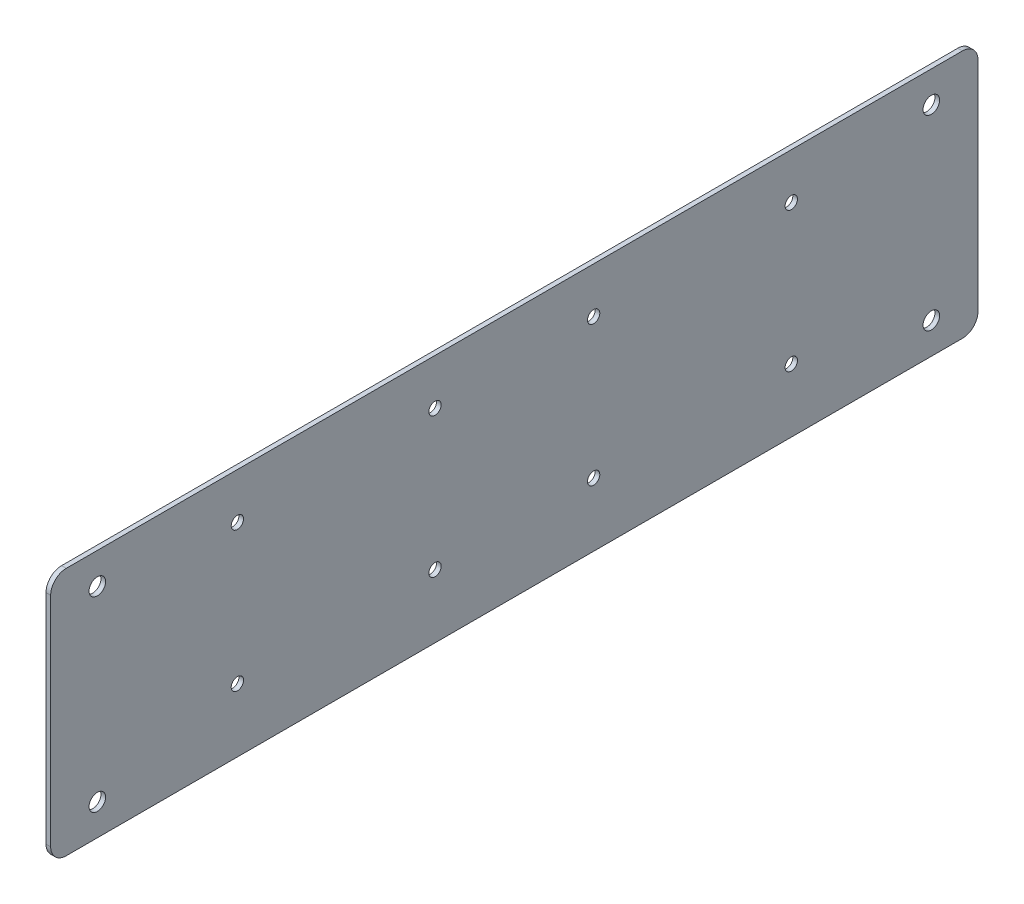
SolidWorks part; units mm, degrees
ref_plane "Front" through (0, 0, 0) normal (0, 0, 1) x (1, 0, 0)
ref_plane "Top" through (0, 0, 0) normal (0, 1, 0) x (1, 0, 0)
ref_plane "Right" through (0, 0, 0) normal (1, 0, 0) x (0, 0, -1)
sketch "Sketch1" plane through (-51.7423, 0, 0) normal (-1, 0, 0) x (0, 0, 1)
  line L0 (99.888, 634.9484) -> (99.888, 81.2564) construction
  line L1 (106.238, 364.5139) -> (471.998, 364.5139)
  line L2 (99.888, 358.1639) -> (99.888, 269.2639)
  line L3 (106.238, 262.9139) -> (471.998, 262.9139)
  line L4 (478.348, 358.1639) -> (478.348, 269.2639)
  arc A0 (478.348, 269.2639) -> (471.998, 262.9139) centre (471.998, 269.2639) cw
  arc A1 (478.348, 358.1639) -> (471.998, 364.5139) centre (471.998, 358.1639) ccw
  arc A2 (99.888, 269.2639) -> (106.238, 262.9139) centre (106.238, 269.2639) ccw
  arc A3 (99.888, 358.1639) -> (106.238, 364.5139) centre (106.238, 358.1639) cw
  point P10 (478.348, 262.9139)
  point P13 (478.348, 364.5139)
  point P18 (99.888, 364.5139)
  dimension "D2" = 6.35
  dimension "D1" = 101.6
  dimension "D3" = 378.46
extrude "Boss-Extrude1" add sketch "Sketch1" along normal blind 1.905
sketch "Sketch2" plane through (-51.7423, 0, 0) normal (1, 0, 0) x (0, 0, -1)
  line L0 (-471.998, 364.5139) -> (-106.238, 364.5139) construction
  line L1 (-478.348, 269.2639) -> (-478.348, 358.1639) construction
  circle A0 centre (-459.298, 351.8139) radius 3.3782
  circle A1 centre (-118.938, 351.8139) radius 3.3782
  circle A2 centre (-118.938, 275.6139) radius 3.3782
  circle A3 centre (-459.298, 275.6139) radius 3.3782
  dimension "D1" = 6.7564
  dimension "D2" = 12.7
  dimension "D3" = 19.05
  dimension "D4" = 2
  dimension "D5" = 2
extrude "Cut-Extrude1" cut sketch "Sketch2" against normal through all both and the other way through all
sketch "Sketch3" plane through (-53.6473, 0, 0) normal (-1, 0, 0) x (0, 0, 1)
  line L0 (106.238, 262.9139) -> (471.998, 262.9139) construction
  line L1 (99.888, 358.1639) -> (99.888, 269.2639) construction
  line L2 (478.348, 269.2639) -> (478.348, 358.1639) construction
  line L3 (99.888, 358.1639) -> (99.888, 269.2639) construction
  circle A0 centre (176.088, 345.8449) radius 2.5146
  circle A1 centre (176.088, 288.7965) radius 2.5146
  circle A2 centre (256.7584, 288.7965) radius 2.5146
  circle A3 centre (256.7584, 345.8449) radius 2.5146
  circle A4 centre (402.148, 345.8449) radius 2.5146
  circle A5 centre (321.4776, 345.8449) radius 2.5146
  circle A6 centre (321.4776, 288.7965) radius 2.5146
  circle A7 centre (402.148, 288.7965) radius 2.5146
  dimension "D1" = 5.0292
  dimension "D2" = 57.0484
  dimension "D3" = 25.8826
  dimension "D5" = 80.6704
  dimension "D4" = 76.2
  dimension "D6" = 378.46
  dimension "D7" = 2
extrude "Cut-Extrude2" cut sketch "Sketch3" against normal through all both and the other way through all
